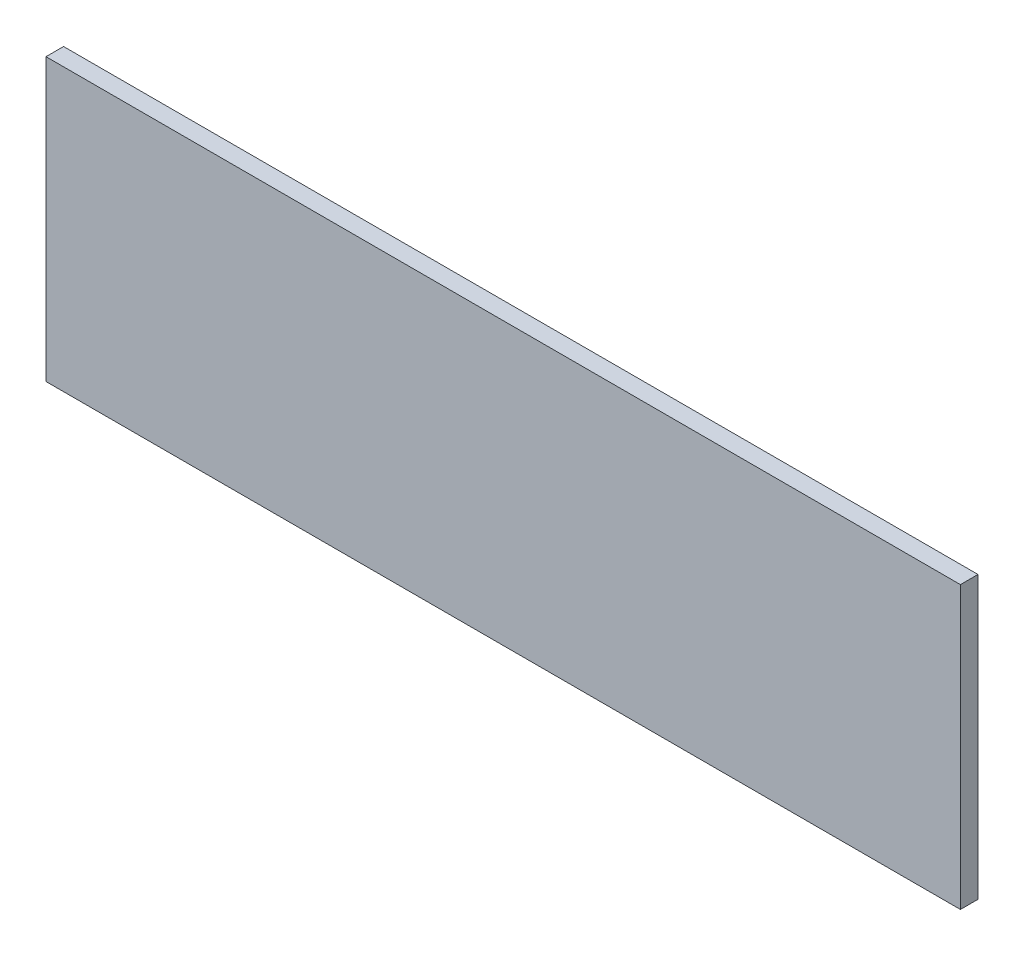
SolidWorks part; units mm, degrees
ref_plane "Front Plane" through (0, 0, 0) normal (0, 0, 1) x (1, 0, 0)
ref_plane "Top Plane" through (0, 0, 0) normal (0, 1, 0) x (1, 0, 0)
ref_plane "Right Plane" through (0, 0, 0) normal (1, 0, 0) x (0, 0, -1)
sketch "Croquis1" plane through (0, 0, 0) normal (0, 0, 1) x (1, 0, 0)
  line L1 (-387.1323, 146.2048) -> (392.8677, 146.2048)
  line L2 (-387.1323, 146.2048) -> (-387.1323, -93.7952)
  line L3 (-387.1323, -93.7952) -> (392.8677, -93.7952)
  line L4 (392.8677, 146.2048) -> (392.8677, -93.7952)
  dimension "D1" = 780
  dimension "D2" = 240
extrude "Saliente-Extruir1" add sketch "Croquis1" along normal blind 15
